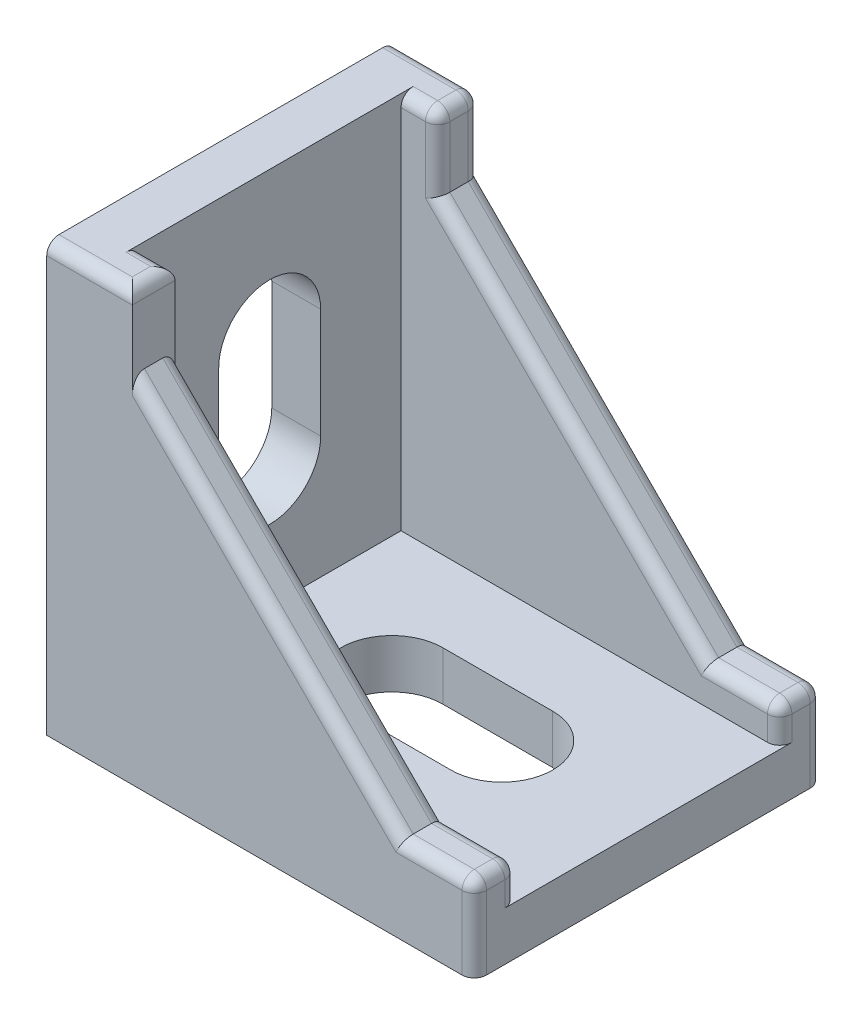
SolidWorks part; units mm, degrees
ref_plane "前视基准面" through (0, 0, 0) normal (0, 0, 1) x (1, 0, 0)
ref_plane "上视基准面" through (0, 0, 0) normal (0, 1, 0) x (1, 0, 0)
ref_plane "右视基准面" through (0, 0, 0) normal (1, 0, 0) x (0, 0, -1)
sketch "草图1" plane through (0, 0, 0) normal (0, 0, 1) x (1, 0, 0)
  line L0 (-60.2778, -22.4837) -> (-56.2778, -22.4837)
  line L1 (-56.2778, -22.4837) -> (-56.2778, -53.4837)
  line L2 (-56.2778, -53.4837) -> (-25.2778, -53.4837)
  line L3 (-25.2778, -53.4837) -> (-25.2778, -57.4837)
  line L4 (-60.2778, -22.4837) -> (-60.2778, -57.4837)
  line L5 (-60.2778, -57.4837) -> (-25.2778, -57.4837)
  dimension "D1" = 4
  dimension "D2" = 4
  dimension "D3" = 31
  dimension "D4" = 31
extrude "凸台-拉伸1" add sketch "草图1" along normal blind 28.5
sketch "草图2" plane through (0, 0, 28.5) normal (0, 0, 1) x (1, 0, 0)
  line L0 (-56.2778, -22.4837) -> (-53.2778, -22.4837)
  line L1 (-53.2778, -22.4837) -> (-53.2778, -28.4837)
  line L2 (-53.2778, -28.4837) -> (-31.2778, -50.4837)
  line L3 (-31.2778, -50.4837) -> (-25.2778, -50.4837)
  line L4 (-25.2778, -50.4837) -> (-25.2778, -53.4837)
  line L5 (-25.2778, -53.4837) -> (-56.2778, -53.4837)
  line L6 (-56.2778, -53.4837) -> (-56.2778, -22.4837)
  dimension "D1" = 3
  dimension "D2" = 6
  dimension "D3" = 3
  dimension "D4" = 6
extrude "凸台-拉伸2" add sketch "草图2" against normal blind 3.5
sketch "草图3" plane through (0, 0, 0) normal (0, 0, -1) x (-1, 0, 0)
  line L0 (56.2778, -22.4837) -> (53.2778, -22.4837)
  line L1 (53.2778, -22.4837) -> (53.2778, -28.4837)
  line L2 (53.2778, -28.4837) -> (31.2778, -50.4837)
  line L3 (31.2778, -50.4837) -> (25.2778, -50.4837)
  line L4 (25.2778, -50.4837) -> (25.2778, -53.4837)
  line L5 (25.2778, -53.4837) -> (56.2778, -53.4837)
  line L6 (56.2778, -53.4837) -> (56.2778, -22.4837)
  dimension "D1" = 3
  dimension "D2" = 6
  dimension "D3" = 3
  dimension "D4" = 6
extrude "凸台-拉伸3" add sketch "草图3" against normal blind 3.5
sketch "草图4" plane through (-60.2778, 0, 0) normal (-1, 0, 0) x (0, 0, 1)
  line L0 (14.25, -22.4837) -> (14.25, -57.4837)
  line L1 (28.5, -22.4837) -> (0, -22.4837) construction
  line L2 (28.5, -57.4837) -> (0, -57.4837) construction
  line L3 (14.25, -34.4837) -> (14.25, -43.4837) construction
  line L4 (18.4209, -34.4837) -> (18.4209, -43.4837)
  line L5 (10.0791, -34.4837) -> (10.0791, -43.4837)
  arc A0 (18.4209, -34.4837) -> (10.0791, -34.4837) centre (14.25, -34.4837) ccw
  arc A1 (10.0791, -43.4837) -> (18.4209, -43.4837) centre (14.25, -43.4837) ccw
  point P8 (14.25, -38.9837)
  dimension "D1" = 9
  dimension "D2" = 12
extrude "切除-拉伸6" cut sketch "草图4" against normal through all contours L5 A1 L4 A0
sketch "草图9" plane through (-60.2778, 0, 0) normal (-1, 0, 0) x (0, 0, 1)
  line L0 (11.35, -24.4837) -> (17.15, -24.4837)
  line L1 (17.15, -24.4837) -> (17.15, -26.4837)
  line L2 (17.15, -26.4837) -> (11.35, -26.4837)
  line L3 (11.35, -26.4837) -> (11.35, -24.4837)
  line L4 (11.35, -52.9837) -> (17.15, -52.9837)
  line L5 (17.15, -52.9837) -> (17.15, -54.9837)
  line L6 (17.15, -54.9837) -> (11.35, -54.9837)
  line L7 (11.35, -54.9837) -> (11.35, -52.9837)
  line L9 (28.5, -57.4837) -> (0, -57.4837) construction
  line L10 (28.5, -22.4837) -> (0, -22.4837) construction
  line L12 (28.5, -22.4837) -> (28.5, -57.4837) construction
  dimension "D1" = 5.8
  dimension "D2" = 5.8
  dimension "D3" = 2
  dimension "D4" = 2
  dimension "D5" = 2
  dimension "D6" = 2.5
  dimension "D7" = 11.35
  dimension "D8" = 11.35
extrude "凸台-拉伸4" add sketch "草图9" along normal blind 2
sketch "草图10" plane through (-60.2778, 0, 0) normal (-1, 0, 0) x (0, 0, 1)
  line L0 (11.35, -24.4837) -> (8, -24.4837)
  line L1 (8, -24.4837) -> (8, -29.4837)
  line L2 (8, -29.4837) -> (20.5, -29.4837)
  line L3 (20.5, -29.4837) -> (20.5, -24.4837)
  line L4 (20.5, -24.4837) -> (17.15, -24.4837)
  line L5 (17.15, -24.4837) -> (17.15, -26.4837)
  line L6 (17.15, -26.4837) -> (11.35, -26.4837)
  line L7 (11.35, -26.4837) -> (17.15, -26.4837) construction
  line L8 (11.35, -24.4837) -> (11.35, -26.4837) construction
  line L9 (11.35, -26.4837) -> (11.35, -24.4837)
  line L10 (11.35, -54.9837) -> (8, -54.9837)
  line L11 (8, -54.9837) -> (8, -49.9837)
  line L12 (8, -49.9837) -> (20.5, -49.9837)
  line L13 (20.5, -49.9837) -> (20.5, -54.9837)
  line L14 (20.5, -54.9837) -> (17.15, -54.9837)
  line L15 (17.15, -54.9837) -> (17.15, -52.9837)
  line L16 (17.15, -52.9837) -> (11.35, -52.9837)
  line L17 (11.35, -52.9837) -> (11.35, -54.9837)
  line L18 (28.5, -22.4837) -> (28.5, -57.4837) construction
  line L19 (0, -22.4837) -> (0, -57.4837) construction
  dimension "D1" = 5
  dimension "D2" = 5
  dimension "D3" = 8
  dimension "D4" = 8
  dimension "D5" = 8
  dimension "D6" = 8
extrude "切除-拉伸7" cut sketch "草图10" against normal blind 2
ref_plane "基准面1" through (-1.397, 1.397, 0) normal (0.7071, -0.7071, 0) x (0, 0, -1)
mirror "镜向1" about plane through (-1.397, 1.397, 0) normal (0.7071, -0.7071, 0) of "切除-拉伸7", "凸台-拉伸4"
mirror "镜向2" about plane through (-1.397, 1.397, 0) normal (0.7071, -0.7071, 0) of "切除-拉伸6"
fillet "圆角1" radius 1 22 edges at (-54.7778, -22.4837, 25) (-53.2778, -22.4837, 26.75) (-56.7778, -22.4837, 28.5) (-25.2778, -50.4837, 26.75) (-25.2778, -51.9837, 25) (-25.2778, -53.9837, 28.5) (-42.2778, -39.4837, 28.5) (-42.2778, -39.4837, 25) (-28.2778, -50.4837, 25) (-28.2778, -50.4837, 28.5) (-25.2778, -53.9837, 0) (-25.2778, -51.9837, 3.5) (-25.2778, -50.4837, 1.75) (-28.2778, -50.4837, 3.5) (-28.2778, -50.4837, 0) (-56.7778, -22.4837, 0) (-54.7778, -22.4837, 3.5) (-53.2778, -22.4837, 1.75) (-53.2778, -25.4837, 3.5) (-53.2778, -25.4837, 0) (-42.2778, -39.4837, 0) (-42.2778, -39.4837, 3.5)
fillet "圆角2" radius 1 8 edges at (-29.2778, -59.4837, 14.25) (-27.2778, -59.4837, 14.25) (-55.7778, -59.4837, 14.25) (-57.7778, -59.4837, 14.25) (-62.2778, -52.9837, 14.25) (-62.2778, -54.9837, 14.25) (-62.2778, -26.4837, 14.25) (-62.2778, -24.4837, 14.25)
